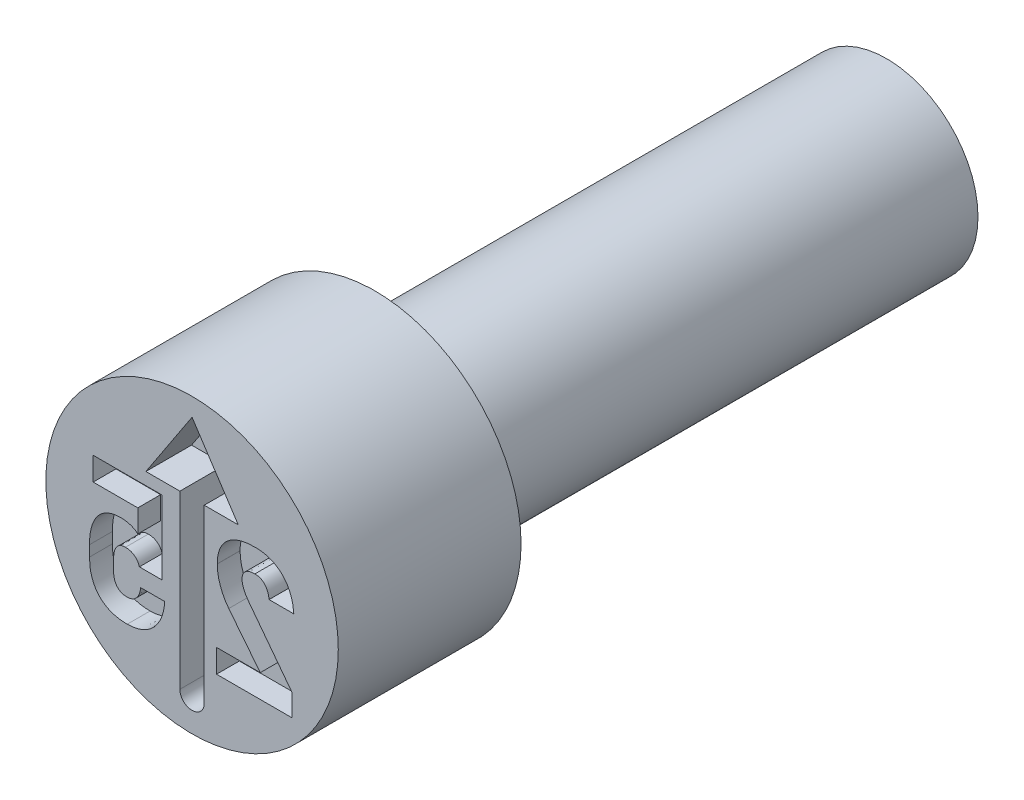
SolidWorks part; units mm, degrees
ref_plane "Front Plane" through (0, 0, 0) normal (0, 0, 1) x (1, 0, 0)
ref_plane "Top Plane" through (0, 0, 0) normal (0, 1, 0) x (1, 0, 0)
ref_plane "Right Plane" through (0, 0, 0) normal (1, 0, 0) x (0, 0, -1)
sketch "Sketch2" plane through (0, 0, 0) normal (1, 0, 0) x (0, 0, -1)
  line L0 (0.4039, 0) -> (50000.4039, 0) construction
  line L6 (0, 0.8) -> (0, 0)
  line L7 (1, 0.8) -> (0, 0.8)
  line L8 (1, 0.5) -> (1, 0.8)
  line L9 (3.8, 0.5) -> (1, 0.5)
  line L10 (3.8, 0) -> (3.8, 0.5)
  line L11 (0, 0) -> (3.8, 0)
  dimension "D1" = 1.6
  dimension "D2" = 1
  dimension "D3" = 3.8
  dimension "D4" = 1
revolve "Revolve1" add sketch "Sketch2" angle 360 about L0
sketch "Sketch3" plane through (0, 0, 0) normal (0, 0, 1) x (1, 0, 0)
  line L0 (0, 0) -> (0, 35000) construction
  line L1 (0.0667, 0.3172) -> (0.0667, -0.6217)
  line L2 (0.2527, 0.3172) -> (0.0667, 0.3172)
  line L3 (0, 0.7007) -> (0.2527, 0.3172)
  line L15 (0, 0.7007) -> (-0.2527, 0.3172)
  line L16 (-0.2527, 0.3172) -> (-0.0667, 0.3172)
  line L17 (-0.0667, 0.3172) -> (-0.0667, -0.6217)
  arc A2 (-0.0667, -0.6217) -> (0.0667, -0.6217) centre (0, -0.6217) ccw
extrude "Cut-Extrude4" cut sketch "Sketch3" against normal blind 0.25
sketch "Sketch4" plane through (0, 0, 0) normal (0, 0, 1) x (1, 0, 0)
  text T0 "2 5" font "Bahnschrift" height 0.7
  dimension "D2" = 0.45
extrude "Cut-Extrude5" cut sketch "Sketch4" against normal blind 0.125
